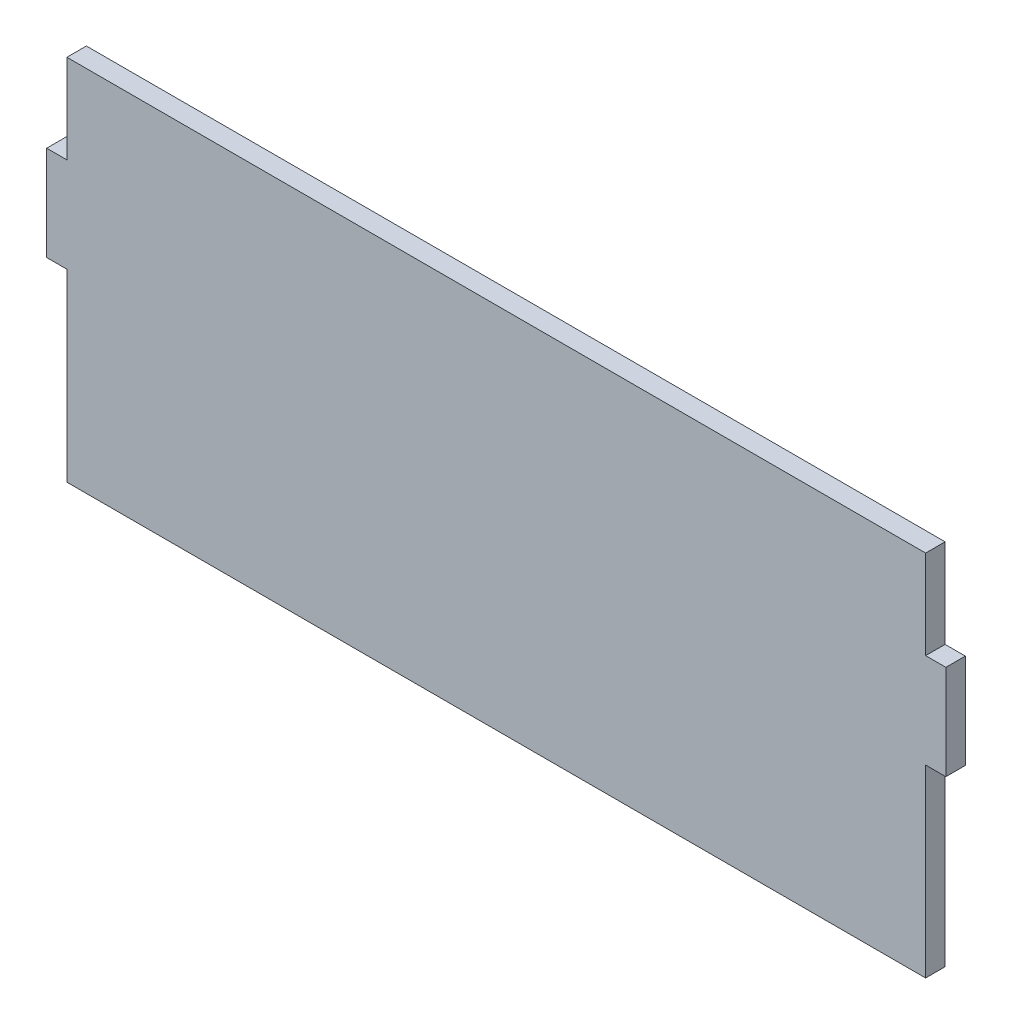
SolidWorks part; units mm, degrees
ref_plane "Alzado" through (0, 0, 0) normal (0, 0, 1) x (1, 0, 0)
ref_plane "Planta" through (0, 0, 0) normal (0, 1, 0) x (1, 0, 0)
ref_plane "Vista lateral" through (0, 0, 0) normal (1, 0, 0) x (0, 0, -1)
sketch "Croquis1" plane through (0, 0, 0) normal (0, 0, 1) x (1, 0, 0)
  line L0 (-72.7367, 8.9074) -> (-72.7367, -2.2332)
  line L9 (-72.7367, -3.7331) -> (-70.0367, -3.7331)
  line L11 (-70.0367, 20.7668) -> (-44.2837, 20.7668)
  line L14 (47.2633, -2.2332) -> (47.2633, 8.9074)
  line L15 (44.5633, 20.7668) -> (-44.2837, 20.7668)
  line L18 (-70.0367, -3.7331) -> (-70.0367, -28.3482)
  line L19 (-70.0367, 8.9074) -> (-70.0367, 20.7668)
  line L20 (44.5633, 20.7668) -> (44.5633, 8.9074)
  line L21 (-70.0367, -28.3482) -> (44.5633, -28.3482)
  line L23 (-72.7367, 8.9074) -> (-70.0367, 8.9074)
  line L24 (44.5633, 8.9074) -> (47.2633, 8.9074)
  line L25 (44.5633, -3.7331) -> (44.5633, -28.3482)
  line L27 (-72.7367, -3.7331) -> (-72.7367, -2.2332)
  line L29 (47.2633, -3.7331) -> (47.2633, -2.2332)
  line L30 (44.5633, -3.7331) -> (47.2633, -3.7331)
extrude "Saliente-Extruir1" add sketch "Croquis1" along normal blind 2.6
